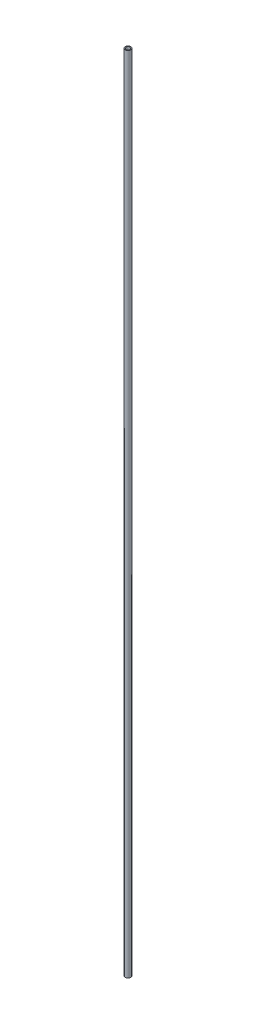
SolidWorks part; units mm, degrees
ref_plane "Front Plane" through (0, 0, 0) normal (0, 0, 1) x (1, 0, 0)
ref_plane "Top Plane" through (0, 0, 0) normal (0, 1, 0) x (1, 0, 0)
ref_plane "Right Plane" through (0, 0, 0) normal (1, 0, 0) x (0, 0, -1)
sketch "Sketch1" plane through (0, 0, 0) normal (0, 1, 0) x (1, 0, 0)
  circle A0 centre (0, 0) radius 7.6454
  circle A1 centre (0, 0) radius 10.668
  dimension "D1" = 21.336
  dimension "D2" = 15.2908
extrude "Boss-Extrude1" add sketch "Sketch1" along normal blind 3048
